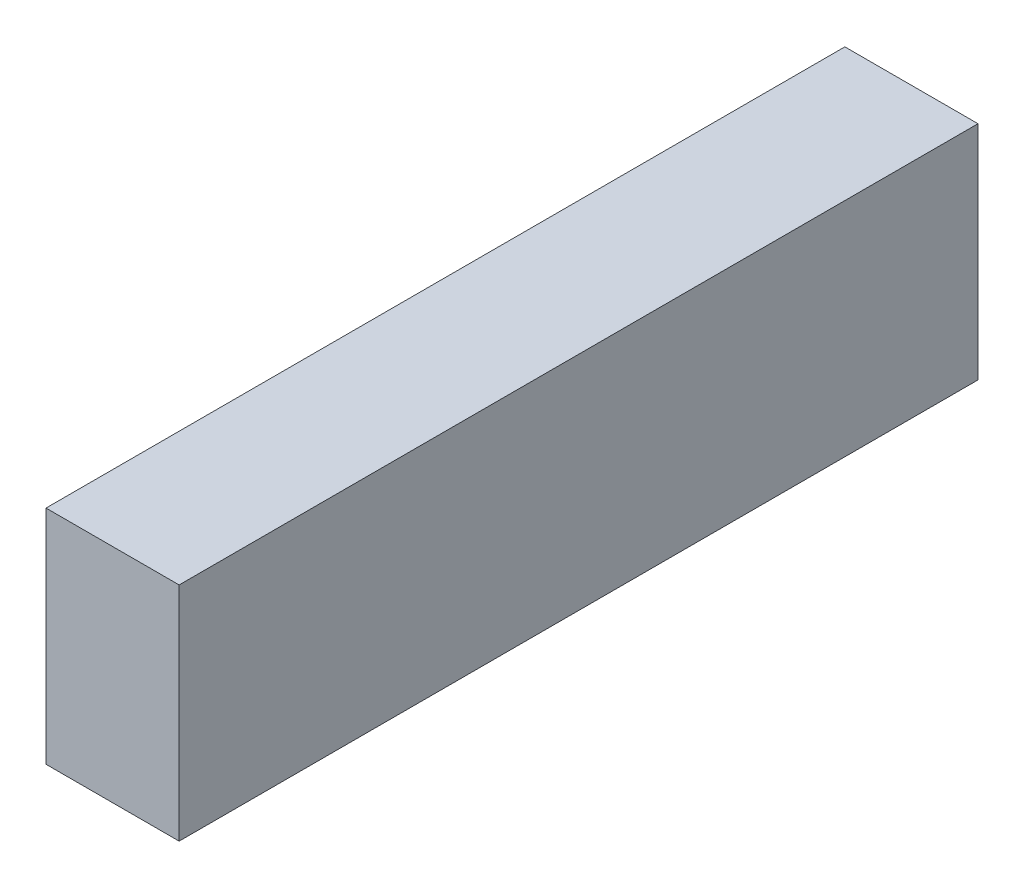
SolidWorks part; units mm, degrees
ref_plane "Plan de face" through (0, 0, 0) normal (0, 0, 1) x (1, 0, 0)
ref_plane "Plan de dessus" through (0, 0, 0) normal (0, 1, 0) x (1, 0, 0)
ref_plane "Plan de droite" through (0, 0, 0) normal (1, 0, 0) x (0, 0, -1)
sketch "Esquisse1" plane through (0, 0, 0) normal (1, 0, 0) x (0, 0, -1)
  line L1 (4.8267, 4.2751) -> (94.8267, 4.2751)
  line L2 (4.8267, 4.2751) -> (4.8267, 29.2751)
  line L3 (4.8267, 29.2751) -> (94.8267, 29.2751)
  line L4 (94.8267, 4.2751) -> (94.8267, 29.2751)
extrude "Extrusion1" add sketch "Esquisse1" along normal blind 15
